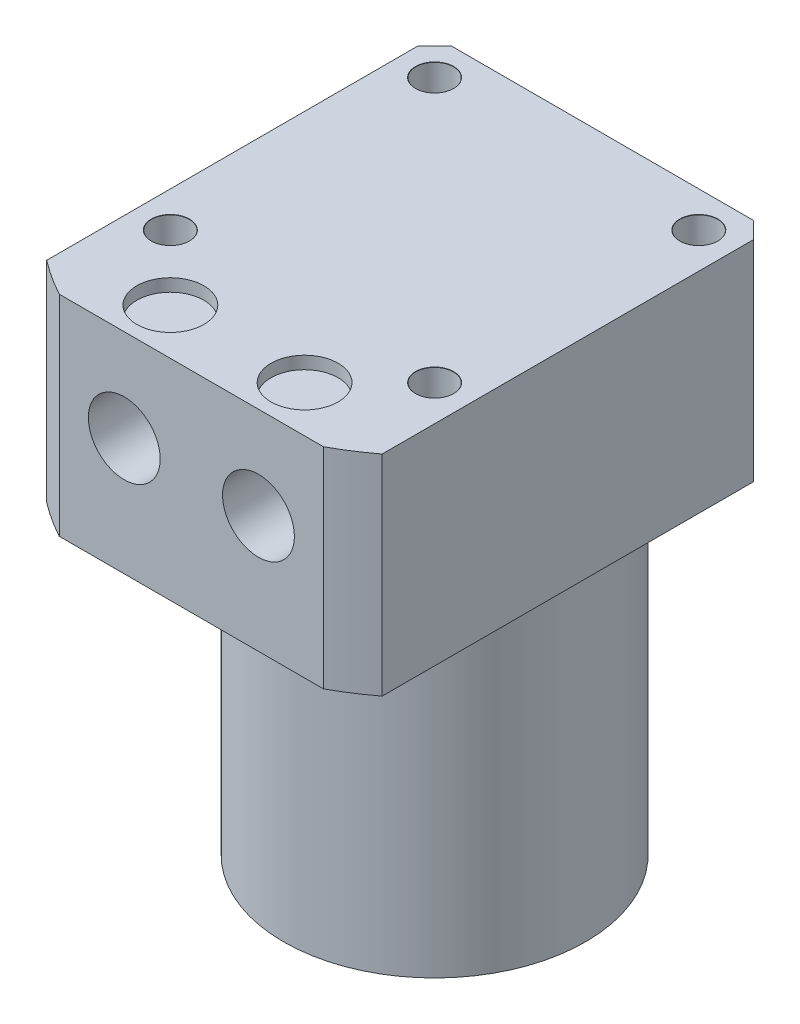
SolidWorks part; units mm, degrees
ref_plane "Front Plane" through (0, 0, 0) normal (0, 0, 1) x (1, 0, 0)
ref_plane "Top Plane" through (0, 0, 0) normal (0, 1, 0) x (1, 0, 0)
ref_plane "Right Plane" through (0, 0, 0) normal (1, 0, 0) x (0, 0, -1)
sketch "Sketch1" plane through (0, 0, 0) normal (0, 0, 1) x (1, 0, 0)
  line L0 (0, 87.0508) -> (0, 0) construction
  line L1 (0, 0) -> (-18, 0)
  line L2 (-18, 0) -> (-18, 39.5)
  line L3 (-18, 39.5) -> (-33, 39.5)
  line L4 (-33, 39.5) -> (-33, 64.5)
  line L6 (-33, 64.5) -> (0, 64.5)
  line L7 (0, 0) -> (0, 64.5)
  dimension "D1" = 18
  dimension "D2" = 39.5
  dimension "D3" = 33
  dimension "D5" = 25
revolve "Revolve1" add sketch "Sketch1" angle 360 about L0
sketch "Sketch2" plane through (0, 64.5, 0) normal (0, 1, 0) x (1, 0, 0)
  line L0 (0, 0) -> (0, 20) construction
  line L1 (-20, 20) -> (20, 20)
  line L2 (-20, 20) -> (-20, -29)
  line L3 (-20, -29) -> (20, -29)
  line L4 (20, 20) -> (20, -29)
  dimension "D1" = 49
  dimension "D2" = 40
  dimension "D3" = 20
extrude "Cut-Extrude2" cut sketch "Sketch2" against normal through all flip side to cut
chamfer "Chamfer1" distance 2 angle 45 2 edges at (20, 52, -20) (-20, 52, -20)
hole_wizard "Ø8.0 (8) Diameter Hole1" positions "Sketch4" profile "Sketch3" hole size "Ø8.0" standard "ISO"
sketch "Sketch4" plane through (-22.9405, 64.5, 22.7051) normal (0, -1, 0) x (1, 0, 0)
  line L0 (14.9405, 0.7949) -> (30.9405, 0.7949) construction
  line L2 (22.9405, 0.7949) -> (22.9405, -22.7051) construction
  point P0 (14.9405, 0.7949)
  point P1 (30.9405, 0.7949)
  dimension "D1" = 16
  dimension "D2" = 23.5
sketch "Sketch3" plane through (-8, 64.5, 23.5) normal (1, 0, 0) x (0, 0, 1)
  line L0 (0, 0) -> (0, 1.5)
  line L1 (0, 1.5) -> (4, 1.5)
  line L2 (4, 1.5) -> (4, 0)
  line L5 (4, 0) -> (0, 0)
  line L10 (0, 1.5) -> (-4, 1.5) construction
  line L11 (0, -6.35) -> (0, 107.95) construction
  dimension "Hole Dia." = 8
  dimension "Hole Depth" = 1.5
  dimension "Drill Angle" = 180
hole_wizard "G1/8 Tapped Hole1" positions "Sketch6" profile "Sketch5" tap size "G1/8" standard "ISO"
sketch "Sketch6" plane through (0, 0, 29) normal (0, 0, 1) x (1, 0, 0)
  line L0 (-8, 53.5) -> (8, 53.5) construction
  line L4 (0, 53.5) -> (0, 64.5) construction
  line L5 (-15.748, 64.5) -> (15.748, 64.5) construction
  point P0 (-8, 53.5)
  point P1 (8, 53.5)
  dimension "D1" = 11
  dimension "D2" = 16
sketch "Sketch5" plane through (-8, 53.5, 29) normal (1, 0, 0) x (0, -1, 0)
  line L0 (0, 0) -> (0, 22.18)
  line L1 (0, 22.18) -> (4.283, 22.18)
  line L2 (4.283, 22.18) -> (4.283, 0)
  line L5 (4.283, 0) -> (0, 0)
  line L10 (0, 22.18) -> (-4.283, 22.18) construction
  line L11 (0, -6.35) -> (0, 107.95) construction
  dimension "Tap Drill Dia." = 8.566
  dimension "Tap Drill Depth" = 22.18
  dimension "Drill Angle" = 180
hole_wizard "CBORE for M4 Hex Socket Head Cap Screw1" positions "Sketch8" profile "Sketch7" counterbore size "M4" standard "ISO"
sketch "Sketch8" plane through (-33.2535, 39.5, 49.2524) normal (0, 1, 0) x (-1, 0, 0)
  line L1 (-17.5035, -33.5024) -> (-49.0035, -33.5024)
  line L2 (-17.5035, -33.5024) -> (-17.5035, -65.0024)
  line L3 (-17.5035, -65.0024) -> (-49.0035, -65.0024)
  line L4 (-49.0035, -33.5024) -> (-49.0035, -65.0024)
  line L7 (-33.2535, -49.2524) -> (-33.2535, -33.5024) construction
  line L9 (-33.2535, -49.2524) -> (-17.5035, -49.2524) construction
  point P0 (-17.5035, -65.0024)
  point P1 (-49.0035, -65.0024)
  point P3 (-49.0035, -33.5024)
  point P5 (-17.5035, -33.5024)
  dimension "D1" = 31.5
  dimension "D2" = 31.5
sketch "Sketch7" plane through (-15.75, 39.5, -15.75) normal (1, 0, 0) x (0, 0, -1)
  line L0 (0, 0) -> (0, 25)
  line L1 (2.25, 24.975) -> (2.275, 25)
  line L2 (2.25, 24.975) -> (2.25, 4)
  line L3 (2.25, 4) -> (4, 4)
  line L4 (4, 4) -> (4, 0)
  line L5 (4, 0) -> (0, 0)
  line L11 (0, -6.35) -> (0, 107.95) construction
  line L12 (2.275, 25) -> (0, 25)
  line L13 (-2.25, 24.975) -> (-2.275, 25) construction
  dimension "Thru Hole Dia." = 4.5
  dimension "Thru Hole Depth" = 25
  dimension "C'Bore Dia." = 8
  dimension "C'Bore Depth" = 4
  dimension "Far C'Sink Dia." = 4.55
  dimension "Far C'Sink Angle" = 90
